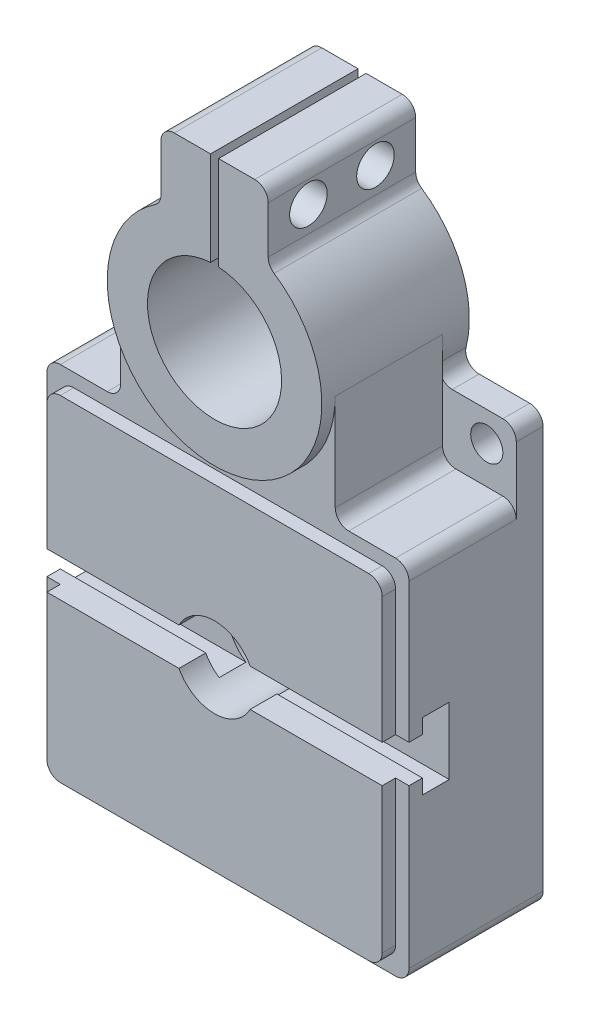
SolidWorks part; units mm, degrees
ref_plane "前视基准面" through (0, 0, 0) normal (0, 0, 1) x (1, 0, 0)
ref_plane "上视基准面" through (0, 0, 0) normal (0, 1, 0) x (1, 0, 0)
ref_plane "右视基准面" through (0, 0, 0) normal (1, 0, 0) x (0, 0, -1)
sketch "草图1" plane through (0, 0, 0) normal (0, 0, 1) x (1, 0, 0)
  line L0 (0, 0) -> (67.5, 0) construction
  line L1 (67.5, 84) -> (67.5, -66)
  line L2 (62.5, -71) -> (-62.5, -71)
  line L3 (-67.5, -66) -> (-67.5, 84)
  line L4 (0, 0) -> (0, 105) construction
  line L5 (0, 105) -> (0, 165) construction
  line L6 (0, 165) -> (15, 165)
  line L7 (0, 165) -> (-15, 165)
  line L8 (-20, 160) -> (-20, 142.4166)
  line L9 (20, 160) -> (20, 142.4166)
  line L10 (-62.5, 89) -> (-43.6348, 89)
  line L11 (0, 0) -> (-56.5, 0) construction
  line L12 (-56.5, 0) -> (-56.5, 78) construction
  line L13 (43.6348, 89) -> (62.5, 89)
  circle A0 centre (0, 105) radius 25
  arc A1 (-22.2222, 138.2592) -> (-38.7865, 95.2222) centre (0, 105) ccw
  arc A2 (67.5, -66) -> (62.5, -71) centre (62.5, -66) cw
  arc A3 (-67.5, -66) -> (-62.5, -71) centre (-62.5, -66) ccw
  arc A4 (62.5, 89) -> (67.5, 84) centre (62.5, 84) cw
  arc A5 (-67.5, 84) -> (-62.5, 89) centre (-62.5, 84) cw
  circle A6 centre (-56.5, 78) radius 6
  circle A7 centre (56.5, 78) radius 6
  arc A8 (20, 142.4166) -> (22.2222, 138.2592) centre (25, 142.4166) ccw
  arc A9 (-20, 142.4166) -> (-22.2222, 138.2592) centre (-25, 142.4166) cw
  arc A10 (15, 165) -> (20, 160) centre (15, 160) cw
  arc A11 (-15, 165) -> (-20, 160) centre (-15, 160) ccw
  arc A12 (38.7865, 95.2222) -> (22.2222, 138.2592) centre (0, 105) ccw
  arc A13 (38.7865, 95.2222) -> (43.6348, 89) centre (43.6348, 94) ccw
  arc A14 (-38.7865, 95.2222) -> (-43.6348, 89) centre (-43.6348, 94) cw
  point P39 (36.6606, 89)
  dimension "D1" = 5
  dimension "D2" = 5
  dimension "D3" = 5
extrude "凸台-拉伸1" add sketch "草图1" along normal blind 10
sketch "草图2" plane through (0, 0, 10) normal (0, 0, 1) x (1, 0, 0)
  line L0 (-62.5, -71) -> (62.5, -71) construction
  line L1 (67.5, -66) -> (67.5, 84) construction
  line L2 (-67.5, 84) -> (-67.5, -66) construction
  line L3 (-62.5, -71) -> (62.5, -71)
  line L4 (67.5, -66) -> (67.5, 59)
  line L5 (-67.5, 59) -> (-67.5, -66)
  line L6 (0, -71) -> (0, 64) construction
  line L7 (-62.5, 64) -> (-45, 64)
  line L8 (-40, 69) -> (-40, 105)
  line L9 (40, 69) -> (40, 105)
  line L10 (20, 142.4166) -> (20, 160) construction
  line L11 (15, 165) -> (-15, 165) construction
  line L12 (-20, 160) -> (-20, 142.4166) construction
  line L13 (20, 142.4166) -> (20, 160)
  line L14 (15, 165) -> (-15, 165)
  line L15 (-20, 160) -> (-20, 142.4166)
  line L16 (45, 64) -> (62.5, 64)
  arc A0 (-67.5, -66) -> (-62.5, -71) centre (-62.5, -66) ccw construction
  arc A1 (62.5, -71) -> (67.5, -66) centre (62.5, -66) ccw construction
  arc A2 (-67.5, -66) -> (-62.5, -71) centre (-62.5, -66) ccw
  arc A3 (62.5, -71) -> (67.5, -66) centre (62.5, -66) ccw
  arc A4 (-62.5, 64) -> (-67.5, 59) centre (-62.5, 59) ccw
  arc A5 (67.5, 59) -> (62.5, 64) centre (62.5, 59) ccw
  arc A6 (38.7865, 95.2222) -> (22.2222, 138.2592) centre (0, 105) ccw construction
  arc A7 (20, 142.4166) -> (22.2222, 138.2592) centre (25, 142.4166) ccw construction
  arc A8 (20, 160) -> (15, 165) centre (15, 160) ccw construction
  arc A9 (-15, 165) -> (-20, 160) centre (-15, 160) ccw construction
  arc A10 (-22.2222, 138.2592) -> (-20, 142.4166) centre (-25, 142.4166) ccw construction
  arc A11 (-22.2222, 138.2592) -> (-38.7865, 95.2222) centre (0, 105) ccw construction
  circle A12 centre (0, 105) radius 25 construction
  arc A13 (40, 105) -> (22.2222, 138.2592) centre (0, 105) ccw
  arc A14 (20, 142.4166) -> (22.2222, 138.2592) centre (25, 142.4166) ccw
  arc A15 (20, 160) -> (15, 165) centre (15, 160) ccw
  arc A16 (-15, 165) -> (-20, 160) centre (-15, 160) ccw
  arc A17 (-22.2222, 138.2592) -> (-20, 142.4166) centre (-25, 142.4166) ccw
  arc A18 (-22.2222, 138.2592) -> (-40, 105) centre (0, 105) ccw
  circle A19 centre (0, 105) radius 25
  arc A20 (40, 69) -> (45, 64) centre (45, 69) ccw
  arc A21 (-40, 69) -> (-45, 64) centre (-45, 69) cw
  point P40 (40, 64)
  point P43 (-40, 64)
  dimension "D1" = 5
  dimension "D2" = 5
extrude "凸台-拉伸2" add sketch "草图2" along normal blind 40
sketch "草图3" plane through (0, 0, 50) normal (0, 0, 1) x (1, 0, 0)
  line L0 (0, 0) -> (-62.5, 0) construction
  line L1 (-62.5, 54) -> (-62.5, -61)
  line L2 (-57.5, -66) -> (57.5, -66)
  line L3 (62.5, -61) -> (62.5, 54)
  line L4 (57.5, 59) -> (-57.5, 59)
  arc A0 (-57.5, 59) -> (-62.5, 54) centre (-57.5, 54) ccw
  arc A1 (-62.5, -61) -> (-57.5, -66) centre (-57.5, -61) ccw
  arc A2 (62.5, -61) -> (57.5, -66) centre (57.5, -61) cw
  arc A3 (62.5, 54) -> (57.5, 59) centre (57.5, 54) ccw
  dimension "D1" = 5
extrude "凸台-拉伸3" add sketch "草图3" along normal blind 5
sketch "草图4" plane through (0, 0, 50) normal (0, 0, 1) x (1, 0, 0)
  line L0 (20, 142.4166) -> (20, 160) construction
  line L1 (-20, 160) -> (-20, 142.4166) construction
  line L2 (15, 165) -> (-15, 165) construction
  line L3 (20, 142.4166) -> (20, 160)
  line L4 (-20, 160) -> (-20, 142.4166)
  line L5 (15, 165) -> (-15, 165)
  circle A0 centre (0, 105) radius 25 construction
  circle A1 centre (0, 105) radius 25
  arc A2 (-22.2222, 138.2592) -> (22.2222, 138.2592) centre (0, 105) ccw
  arc A3 (20, 142.4166) -> (22.2222, 138.2592) centre (25, 142.4166) ccw construction
  arc A4 (20, 160) -> (15, 165) centre (15, 160) ccw construction
  arc A5 (-22.2222, 138.2592) -> (-20, 142.4166) centre (-25, 142.4166) ccw construction
  arc A6 (-15, 165) -> (-20, 160) centre (-15, 160) ccw construction
  arc A7 (20, 142.4166) -> (22.2222, 138.2592) centre (25, 142.4166) ccw
  arc A8 (20, 160) -> (15, 165) centre (15, 160) ccw
  arc A9 (-22.2222, 138.2592) -> (-20, 142.4166) centre (-25, 142.4166) ccw
  arc A10 (-15, 165) -> (-20, 160) centre (-15, 160) ccw
extrude "凸台-拉伸4" add sketch "草图4" along normal blind 5
sketch "草图5" plane through (0, 0, 0) normal (0, 0, -1) x (-1, 0, 0)
  line L0 (0, 0) -> (57.5, 0) construction
  line L1 (57.5, 49) -> (57.5, -56)
  line L2 (52.5, -61) -> (-52.5, -61)
  line L3 (-57.5, -56) -> (-57.5, 49)
  line L4 (-52.5, 54) -> (-35, 54)
  line L5 (0, 54) -> (0, 69) construction
  line L6 (0, 69) -> (25, 69)
  line L7 (0, 69) -> (-25, 69)
  line L8 (-30, 64) -> (-30, 59)
  line L9 (30, 64) -> (30, 59)
  line L10 (35, 54) -> (52.5, 54)
  arc A0 (-52.5, 54) -> (-57.5, 49) centre (-52.5, 49) ccw
  arc A1 (-57.5, -56) -> (-52.5, -61) centre (-52.5, -56) ccw
  arc A2 (57.5, -56) -> (52.5, -61) centre (52.5, -56) cw
  arc A3 (57.5, 49) -> (52.5, 54) centre (52.5, 49) ccw
  arc A4 (25, 69) -> (30, 64) centre (25, 64) cw
  arc A5 (30, 59) -> (35, 54) centre (35, 59) ccw
  arc A6 (-35, 54) -> (-30, 59) centre (-35, 59) ccw
  arc A7 (-25, 69) -> (-30, 64) centre (-25, 64) ccw
  dimension "D1" = 5
  dimension "D2" = 5
extrude "切除-拉伸1" cut sketch "草图5" against normal blind 45
sketch "草图6" plane through (0, 0, 45) normal (0, 0, -1) x (-1, 0, 0)
  line L1 (-57.5, 20) -> (57.5, 20)
  line L2 (-57.5, 20) -> (-57.5, -20)
  line L3 (-57.5, -20) -> (57.5, -20)
  line L4 (57.5, 20) -> (57.5, -20)
  line L5 (-57.5, 20) -> (57.5, -20) construction
  line L6 (-57.5, -20) -> (57.5, 20) construction
  point P0 (0, 0)
  dimension "D1" = 115
  dimension "D2" = 40
extrude "凸台-拉伸5" add sketch "草图6" along normal blind 20
fillet "圆角1" radius 10 1 edges at (57.5, -20, 35)
fillet "圆角2" radius 10 3 edges at (57.5, 20, 35) (-57.5, 20, 35) (-57.5, -20, 35)
sketch "草图7" plane through (-67.5, 0, 0) normal (-1, 0, 0) x (0, 0, 1)
  line L0 (0, 0) -> (35, 0) construction
  line L1 (35, 12.5) -> (35, -12.5)
  line L2 (35, -12.5) -> (45, -12.5)
  line L3 (45, -12.5) -> (45, -7)
  line L4 (35, 12.5) -> (45, 12.5)
  line L5 (45, 12.5) -> (45, 7)
  line L6 (45, 7) -> (56, 7)
  line L7 (45, -7) -> (56, -7)
  line L8 (56, 7) -> (56, -7)
  dimension "D1" = 7
  dimension "D2" = 11
  dimension "D3" = 11
extrude "切除-拉伸3" cut sketch "草图7" against normal blind 148
sketch "草图8" plane through (0, 0, 25) normal (0, 0, -1) x (-1, 0, 0)
  circle A0 centre (0, 0) radius 15
extrude "切除-拉伸4" cut sketch "草图8" against normal through all
sketch "草图9" plane through (0, 165, 0) normal (0, 1, 0) x (1, 0, 0)
  line L0 (0, 0) -> (0, -55) construction
  line L1 (15, 0) -> (-15, 0) construction
  line L3 (-1.5, 2.5) -> (1.5, 2.5)
  line L4 (-1.5, 2.5) -> (-1.5, -57.5)
  line L5 (-1.5, -57.5) -> (1.5, -57.5)
  line L6 (1.5, 2.5) -> (1.5, -57.5)
  line L7 (-1.5, 2.5) -> (1.5, -57.5) construction
  line L8 (-1.5, -57.5) -> (1.5, 2.5) construction
  point P4 (0, -27.5)
  dimension "D1" = 60
  dimension "D2" = 3
extrude "切除-拉伸5" cut sketch "草图9" against normal blind 41
sketch "草图10" plane through (20, 0, 0) normal (1, 0, 0) x (0, 0, -1)
  line L0 (0, 142.4166) -> (0, 160) construction
  line L1 (-55, 142.4166) -> (-55, 160) construction
  line L2 (-55, 165) -> (0, 165) construction
  circle A0 centre (-40, 152) radius 7
  circle A1 centre (-15, 152) radius 7
  point P6 (0, 151.2083)
  dimension "D1" = 15
  dimension "D2" = 15
  dimension "D3" = 13
  dimension "D4" = 13
extrude "切除-拉伸6" cut sketch "草图10" against normal blind 10
sketch "草图11" plane through (10, 0, 0) normal (1, 0, 0) x (0, 0, -1)
  circle A0 centre (-40, 152) radius 4.5
  circle A1 centre (-15, 152) radius 4.5
extrude "切除-拉伸8" cut sketch "草图11" against normal blind 45
sketch "草图12" plane through (0, -71, 0) normal (0, -1, 0) x (1, 0, 0)
  line L0 (-62.5, 0) -> (62.5, 0) construction
  line L1 (67.5, 50) -> (67.5, 0) construction
  line L2 (-67.5, 50) -> (-67.5, 0) construction
  circle A0 centre (32, 25) radius 10
  circle A1 centre (-47, 25) radius 2.5
  circle A2 centre (47, 25) radius 2.5
  dimension "D1" = 25
  dimension "D2" = 25
  dimension "D3" = 25
  dimension "D4" = 35.5
  dimension "D5" = 20.5
  dimension "D6" = 94
extrude "切除-拉伸9" cut sketch "草图12" against normal blind 10
sketch "草图13" plane through (-67.5, 0, 0) normal (-1, 0, 0) x (0, 0, 1)
  line L0 (0, 84) -> (0, -66) construction
  line L1 (50, 64) -> (10, 64) construction
  circle A0 centre (22, 37) radius 10.5
  dimension "D1" = 22
  dimension "D2" = 27
extrude "切除-拉伸11" cut sketch "草图13" against normal blind 15
